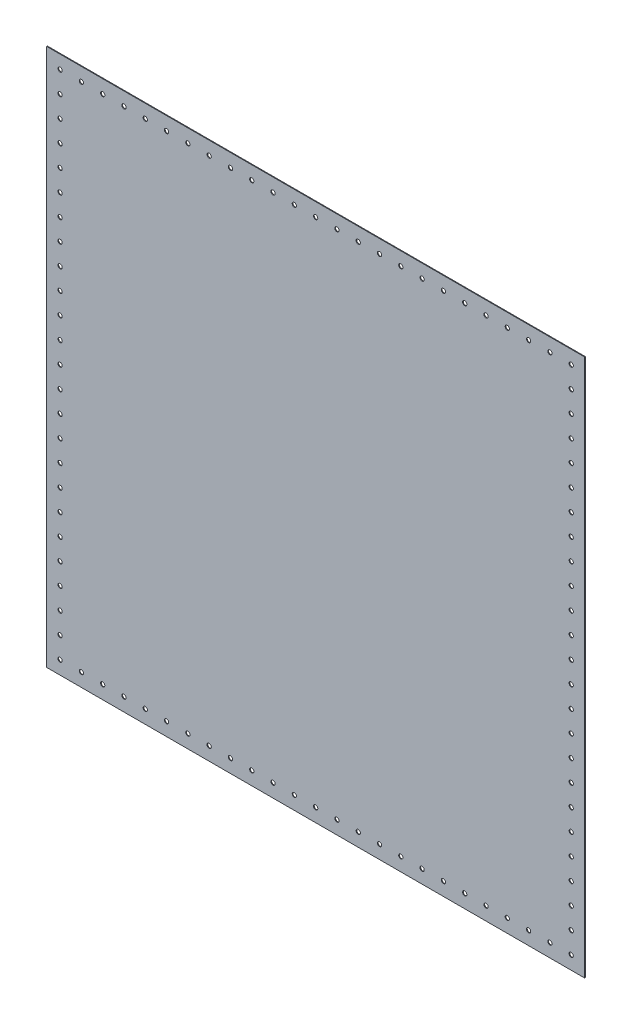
SolidWorks part; units mm, degrees
ref_plane "Front Plane" through (0, 0, 0) normal (1, 0, 0) x (0, 1, 0)
ref_plane "Top Plane" through (0, 0, 0) normal (0, 0, 1) x (0, 1, 0)
ref_plane "Right Plane" through (0, 0, 0) normal (0, 1, 0) x (-1, 0, 0)
sketch "sk 48in boundary" plane through (0, 0, 0) normal (0, 0, 1) x (0, 1, 0)
  line L12 (609.6, 609.6) -> (-609.6, 609.6)
  line L13 (609.6, -609.6) -> (609.6, 609.6)
  line L14 (-609.6, -609.6) -> (609.6, -609.6)
  line L15 (-609.6, 609.6) -> (-609.6, -609.6)
  point P0 (0, 609.6)
  point P1 (-609.6, 0)
  dimension "D1" = 1219.2
  dimension "D2" = 1219.2
ref_plane "48\" pnl right edge" through (0, 609.6, 0) normal (0, 1, 0) x (-1, 0, 0)
ref_plane "48\" pnl left edge" through (0, -609.6, 0) normal (0, 1, 0) x (-1, 0, 0)
ref_plane "48\" pnl bot edge" through (609.6, 0, 0) normal (1, 0, 0) x (0, 1, 0)
ref_plane "48\" pnl top edge" through (-609.6, 0, 0) normal (1, 0, 0) x (0, 1, 0)
sketch "sk 47.986in pnl" plane through (0, 0, 0) normal (0, 0, 1) x (0, 1, 0)
  line B0 (-609.4222, 0) -> (609.4222, 0) construction
  line B1 (-609.4222, 609.4222) -> (609.4222, 609.4222)
  line B2 (-609.4222, 609.4222) -> (-609.4222, -609.4222)
  line B3 (-609.4222, -609.4222) -> (609.4222, -609.4222)
  line B4 (609.4222, 609.4222) -> (609.4222, -609.4222)
  line B5 (0, 609.4222) -> (0, -609.4222) construction
sketch_block_instance "47.986in pnl-1"
sketch_block "47.986in pnl" parameters "D1"=1218.8444, "D2"=1218.8444
sketch "sk 5dia hole pat" plane through (0, 0, 0) normal (0, 0, 1) x (0, 1, 0)
  line L0 (-609.4222, 609.4222) -> (-609.4222, -609.4222) construction
  line L1 (-609.4222, -609.4222) -> (609.4222, -609.4222) construction
  line L2 (-609.4222, 609.4222) -> (609.4222, 609.4222) construction
  line L3 (609.4222, 609.4222) -> (609.4222, -609.4222) construction
  circle B0 centre (-579.12, -579.12) radius 4.826
  circle B1 centre (579.12, 579.12) radius 4.826
  circle B2 centre (-530.86, -579.12) radius 4.826
  circle B3 centre (-482.6, -579.12) radius 4.826
  circle B4 centre (-434.34, -579.12) radius 4.826
  circle B5 centre (-386.08, -579.12) radius 4.826
  circle B6 centre (-337.82, -579.12) radius 4.826
  circle B7 centre (-289.56, -579.12) radius 4.826
  circle B8 centre (-241.3, -579.12) radius 4.826
  circle B9 centre (-193.04, -579.12) radius 4.826
  circle B10 centre (-144.78, -579.12) radius 4.826
  circle B11 centre (-96.52, -579.12) radius 4.826
  circle B12 centre (-48.26, -579.12) radius 4.826
  circle B13 centre (0, -579.12) radius 4.826
  circle B14 centre (48.26, -579.12) radius 4.826
  circle B15 centre (96.52, -579.12) radius 4.826
  circle B16 centre (144.78, -579.12) radius 4.826
  circle B17 centre (193.04, -579.12) radius 4.826
  circle B18 centre (241.3, -579.12) radius 4.826
  circle B19 centre (289.56, -579.12) radius 4.826
  circle B20 centre (337.82, -579.12) radius 4.826
  circle B21 centre (386.08, -579.12) radius 4.826
  circle B22 centre (434.34, -579.12) radius 4.826
  circle B23 centre (482.6, -579.12) radius 4.826
  circle B24 centre (530.86, -579.12) radius 4.826
  circle B25 centre (579.12, -579.12) radius 4.826
  circle B26 centre (-579.12, -530.86) radius 4.826
  circle B27 centre (-579.12, -482.6) radius 4.826
  circle B28 centre (-579.12, -434.34) radius 4.826
  circle B29 centre (-579.12, -386.08) radius 4.826
  circle B30 centre (-579.12, -337.82) radius 4.826
  circle B31 centre (-579.12, -289.56) radius 4.826
  circle B32 centre (-579.12, -241.3) radius 4.826
  circle B33 centre (-579.12, -193.04) radius 4.826
  circle B34 centre (-579.12, -144.78) radius 4.826
  circle B35 centre (-579.12, -96.52) radius 4.826
  circle B36 centre (-579.12, -48.26) radius 4.826
  circle B37 centre (-579.12, 0) radius 4.826
  circle B38 centre (-579.12, 48.26) radius 4.826
  circle B39 centre (-579.12, 96.52) radius 4.826
  circle B40 centre (-579.12, 144.78) radius 4.826
  circle B41 centre (-579.12, 193.04) radius 4.826
  circle B42 centre (-579.12, 241.3) radius 4.826
  circle B43 centre (-579.12, 289.56) radius 4.826
  circle B44 centre (-579.12, 337.82) radius 4.826
  circle B45 centre (-579.12, 386.08) radius 4.826
  circle B46 centre (-579.12, 434.34) radius 4.826
  circle B47 centre (-579.12, 482.6) radius 4.826
  circle B48 centre (-579.12, 530.86) radius 4.826
  circle B49 centre (-579.12, 579.12) radius 4.826
  circle B50 centre (530.86, 579.12) radius 4.826
  circle B51 centre (482.6, 579.12) radius 4.826
  circle B52 centre (434.34, 579.12) radius 4.826
  circle B53 centre (386.08, 579.12) radius 4.826
  circle B54 centre (337.82, 579.12) radius 4.826
  circle B55 centre (289.56, 579.12) radius 4.826
  circle B56 centre (241.3, 579.12) radius 4.826
  circle B57 centre (193.04, 579.12) radius 4.826
  circle B58 centre (144.78, 579.12) radius 4.826
  circle B59 centre (96.52, 579.12) radius 4.826
  circle B60 centre (48.26, 579.12) radius 4.826
  circle B61 centre (0, 579.12) radius 4.826
  circle B62 centre (-48.26, 579.12) radius 4.826
  circle B63 centre (-96.52, 579.12) radius 4.826
  circle B64 centre (-144.78, 579.12) radius 4.826
  circle B65 centre (-193.04, 579.12) radius 4.826
  circle B66 centre (-241.3, 579.12) radius 4.826
  circle B67 centre (-289.56, 579.12) radius 4.826
  circle B68 centre (-337.82, 579.12) radius 4.826
  circle B69 centre (-386.08, 579.12) radius 4.826
  circle B70 centre (-434.34, 579.12) radius 4.826
  circle B71 centre (-482.6, 579.12) radius 4.826
  circle B72 centre (-530.86, 579.12) radius 4.826
  circle B73 centre (579.12, 530.86) radius 4.826
  circle B74 centre (579.12, 482.6) radius 4.826
  circle B75 centre (579.12, 434.34) radius 4.826
  circle B76 centre (579.12, 386.08) radius 4.826
  circle B77 centre (579.12, 337.82) radius 4.826
  circle B78 centre (579.12, 289.56) radius 4.826
  circle B79 centre (579.12, 241.3) radius 4.826
  circle B80 centre (579.12, 193.04) radius 4.826
  circle B81 centre (579.12, 144.78) radius 4.826
  circle B82 centre (579.12, 96.52) radius 4.826
  circle B83 centre (579.12, 48.26) radius 4.826
  circle B84 centre (579.12, 0) radius 4.826
  circle B85 centre (579.12, -48.26) radius 4.826
  circle B86 centre (579.12, -96.52) radius 4.826
  circle B87 centre (579.12, -144.78) radius 4.826
  circle B88 centre (579.12, -193.04) radius 4.826
  circle B89 centre (579.12, -241.3) radius 4.826
  circle B90 centre (579.12, -289.56) radius 4.826
  circle B91 centre (579.12, -337.82) radius 4.826
  circle B92 centre (579.12, -386.08) radius 4.826
  circle B93 centre (579.12, -434.34) radius 4.826
  circle B94 centre (579.12, -482.6) radius 4.826
  circle B95 centre (579.12, -530.86) radius 4.826
  line B96 (0, -579.12) -> (0, -504.12) construction
  line B97 (-579.12, 0) -> (-504.12, 0) construction
  dimension "D3" = 30.3022
  dimension "D4" = 30.3022
  dimension "D1" = 30.3022
  dimension "D2" = 30.3022
sketch_block_instance "5dia hole pat-1"
sketch_block "5dia hole pat" parameters "D1"=9.652, "D2"=9.652, "D3"=75
extrude "Panel" add sketch "sk 47.986in pnl" along normal blind 1.5875
extrude "Rivet Holes" cut sketch "sk 5dia hole pat" along normal blind 1.5875
